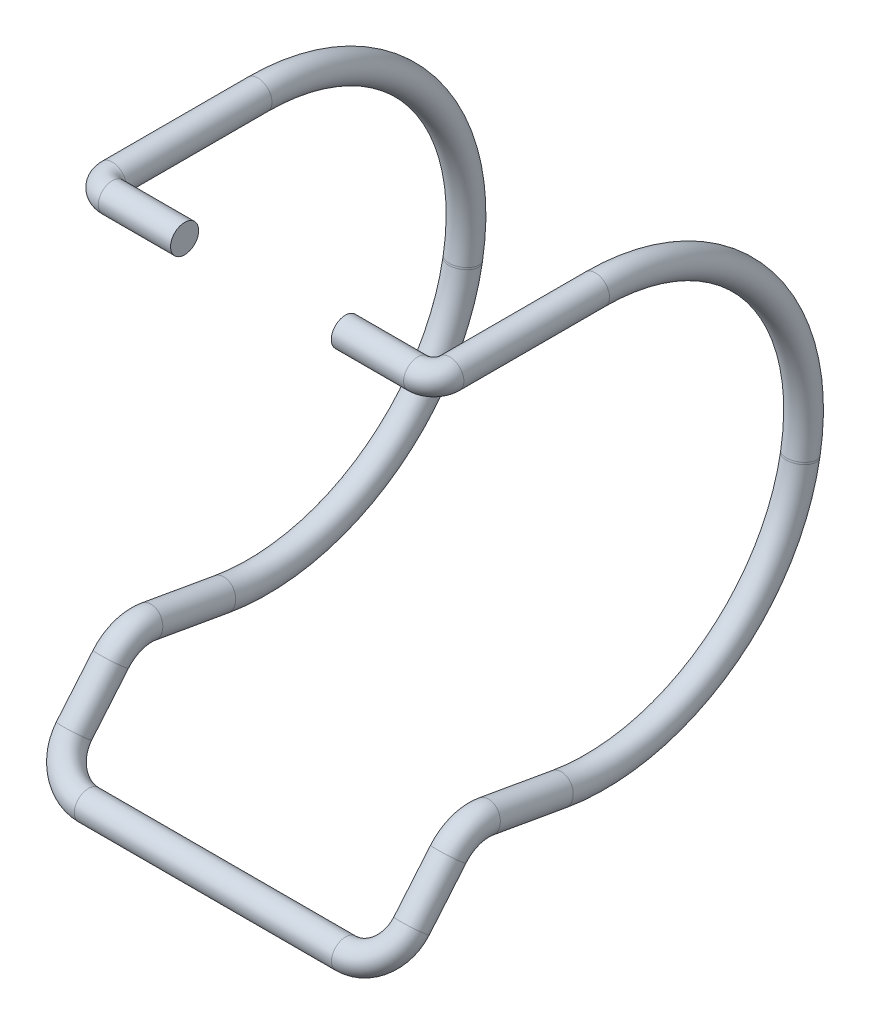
SolidWorks part; units mm, degrees
ref_plane "Anteriore" through (0, 0, 0) normal (0, 0, 1) x (1, 0, 0)
ref_plane "Superiore" through (0, 0, 0) normal (0, 1, 0) x (1, 0, 0)
ref_plane "Destro" through (0, 0, 0) normal (1, 0, 0) x (0, 0, -1)
ref_plane "Piano1" through (21, 0, 0) normal (1, 0, 0) x (0, 0, -1)
sketch "Schizzo1" plane through (21, 0, 0) normal (1, 0, 0) x (0, 0, -1)
  line L0 (0, 0) -> (20, 0)
  line L1 (15.4851, -51.605) -> (6.5103, -50.0225)
  line L2 (1.8119, -51.7326) -> (-5.9744, -61.0119)
  line L3 (20, -26) -> (20, -52) construction
  line L4 (20, -26) -> (15.4851, -51.605) construction
  line L5 (20, 0) -> (98.0064, 0) construction
  line L6 (15.4851, -51.605) -> (96.331, -65.8603) construction
  line L7 (50.9856, 0) -> (41.0901, -56.1199) construction
  arc A0 (20, 0) -> (15.4851, -51.605) centre (20, -26) cw
  arc A1 (6.5103, -50.0225) -> (1.8119, -51.7326) centre (5.6421, -54.9465) ccw
  point P10 (3.6675, -49.5212)
  dimension "D1" = 26
  dimension "D7" = 5
  dimension "D2" = 10
  dimension "D3" = 12
  dimension "D4" = 15
  dimension "D5" = 20
  dimension "D6" = 120
ref_plane "Piano2" through (-21, 0, 0) normal (1, 0, 0) x (0, 0, -1)
sketch "Schizzo3" plane through (-21, 0, 0) normal (1, 0, 0) x (0, 0, -1)
  line L0 (1.8119, -51.7326) -> (-5.9744, -61.0119) construction
  line L1 (15.4851, -51.605) -> (6.5103, -50.0225) construction
  line L2 (0, 0) -> (20, 0) construction
  line L3 (1.8119, -51.7326) -> (-5.9744, -61.0119)
  line L4 (15.4851, -51.605) -> (6.5103, -50.0225)
  line L5 (0, 0) -> (20, 0)
  line L6 (15.4851, -51.605) -> (96.331, -65.8603) construction
  line L7 (50.9856, 0) -> (41.0901, -56.1199) construction
  line L8 (20, 0) -> (98.0064, 0) construction
  line L9 (15.4851, -51.605) -> (96.331, -65.8603)
  line L10 (50.9856, 0) -> (41.0901, -56.1199)
  line L11 (20, 0) -> (98.0064, 0)
  arc A0 (6.5103, -50.0225) -> (1.8119, -51.7326) centre (5.6421, -54.9465) ccw construction
  arc A1 (15.4851, -51.605) -> (20, 0) centre (20, -26) ccw construction
  arc A2 (6.5103, -50.0225) -> (1.8119, -51.7326) centre (5.6421, -54.9465) ccw
  arc A3 (15.4851, -51.605) -> (20, 0) centre (20, -26) ccw
sketch3d "Schizzo3D1"
  line L0 (-16, -61.0119, 5.9744) -> (16, -61.0119, 5.9744)
  line L1 (21, -57.1817, 2.7604) -> (21, -51.7326, -1.8119)
  line L2 (21, -50.0225, -6.5103) -> (21, -51.6224, -15.5836)
  line L3 (21, 0, -2) -> (21, 0, -20.1192)
  line L4 (-21, 0, -20.1192) -> (-21, 0, -2)
  line L5 (-19, 0, 0) -> (19, 0, 0)
  line L6 (-21, -57.1817, 2.7604) -> (-21, -51.7326, -1.8119)
  line L7 (-21, -50.0225, -6.5103) -> (-21, -51.6224, -15.5836)
  line L8 (21, -51.605, -15.4851) -> (21, -50.0225, -6.5103) construction
  line L9 (21, 0, 0) -> (21, 0, -20) construction
  line L10 (21, -30.3975, -45.6257) -> (21, -30.6133, -45.5876)
  line L11 (21, -51.7326, -1.8119) -> (21, -61.0119, 5.9744) construction
  line L12 (-21, -51.7326, -1.8119) -> (-21, -61.0119, 5.9744) construction
  line L13 (-21, -51.605, -15.4851) -> (-21, -50.0225, -6.5103) construction
  line L14 (-21, 0, 0) -> (-21, 0, -20) construction
  line L15 (-21, -30.3975, -45.6257) -> (-21, -30.6133, -45.5876)
  line L16 (-21, 0, -50.9856) -> (-21, -56.1199, -41.0901) construction
  line L17 (21, 0, -50.9856) -> (21, -56.1199, -41.0901) construction
  arc A0 (16, -61.0119, 5.9744) -> (21, -57.1817, 2.7604) centre (16, -57.1817, 2.7604) ccw
  arc A1 (-16, -61.0119, 5.9744) -> (-21, -57.1817, 2.7604) centre (-16, -57.1817, 2.7604) ccw
  arc A3 (21, -50.0225, -6.5103) -> (21, -51.7326, -1.8119) centre (21, -54.9465, -5.6421) ccw
  arc A4 (-21, -50.0225, -6.5103) -> (-21, -51.7326, -1.8119) centre (-21, -54.9465, -5.6421) ccw
  arc A5 (-19, 0, 0) -> (-21, 0, -2) centre (-19, 0, -2) ccw
  arc A6 (21, 0, -2) -> (19, 0, 0) centre (19, 0, -2) ccw
  arc A7 (-21, 0, -20.1192) -> (-21, -30.3975, -45.6257) centre (-21, -25.9, -20.1192) ccw
  arc A8 (21, 0, -20.1192) -> (21, -30.3975, -45.6257) centre (21, -25.9, -20.1192) ccw
  arc A9 (21, -51.6224, -15.5836) -> (21, -30.6133, -45.5876) centre (21, -26.1158, -20.0811) ccw
  arc A10 (-21, -51.6224, -15.5836) -> (-21, -30.6133, -45.5876) centre (-21, -26.1158, -20.0811) ccw
  point P29 (21, -61.0119, 5.9744)
  point P30 (16, -53.9677, 6.5906)
  point P33 (-21, -61.0119, 5.9744)
  point P37 (21, -49.5212, -3.6675)
  point P42 (26, -54.9465, -5.6421)
  point P55 (-16, -60.3956, -1.0698)
  point P58 (-21, -49.5212, -3.6675)
  point P59 (-16, -54.9465, -5.6421)
  point P61 (-21, 0, 0)
  point P63 (-19, -2, -2)
  point P66 (21, 0, 0)
  point P67 (19, -2, -2)
  point P70 (-21, 0, -50.9856)
  point P71 (-46.9, -25.9, -20.1192)
  point P74 (21, 0, -50.9856)
  point P75 (-4.9, -25.9, -20.1192)
  point P78 (21, -56.1199, -41.0901)
  point P79 (46.9, -26.1158, -20.0811)
  point P82 (-21, -56.1199, -41.0901)
  point P83 (4.9, -26.1158, -20.0811)
  dimension "D1" = 5
  dimension "D2" = 5
  dimension "D3" = 5
  dimension "D4" = 5
  dimension "D5" = 2
  dimension "D6" = 2
  dimension "D7" = 25.9
  dimension "D8" = 25.9
  dimension "D9" = 25.9
  dimension "D10" = 25.9
sketch "Schizzo4" plane through (0, 0, 0) normal (1, 0, 0) x (0, 0, -1)
  circle A0 centre (0, 0) radius 1.75
  dimension "D1" = 3.5
sweep "Sweep2" add profiles "Schizzo4" path "Schizzo3D1"
sketch "Schizzo5" plane through (0, 0, 0) normal (0, 0, 1) x (1, 0, 0)
  line L0 (0, 5) -> (0, -5) construction
  line L1 (10, 5) -> (-10, 5)
  line L2 (10, 5) -> (10, -5)
  line L3 (10, -5) -> (-10, -5)
  line L4 (-10, 5) -> (-10, -5)
  dimension "D1" = 20
  dimension "D2" = 10
extrude "Taglio-Estrusione1" cut sketch "Schizzo5" against normal through all and the other way through all
